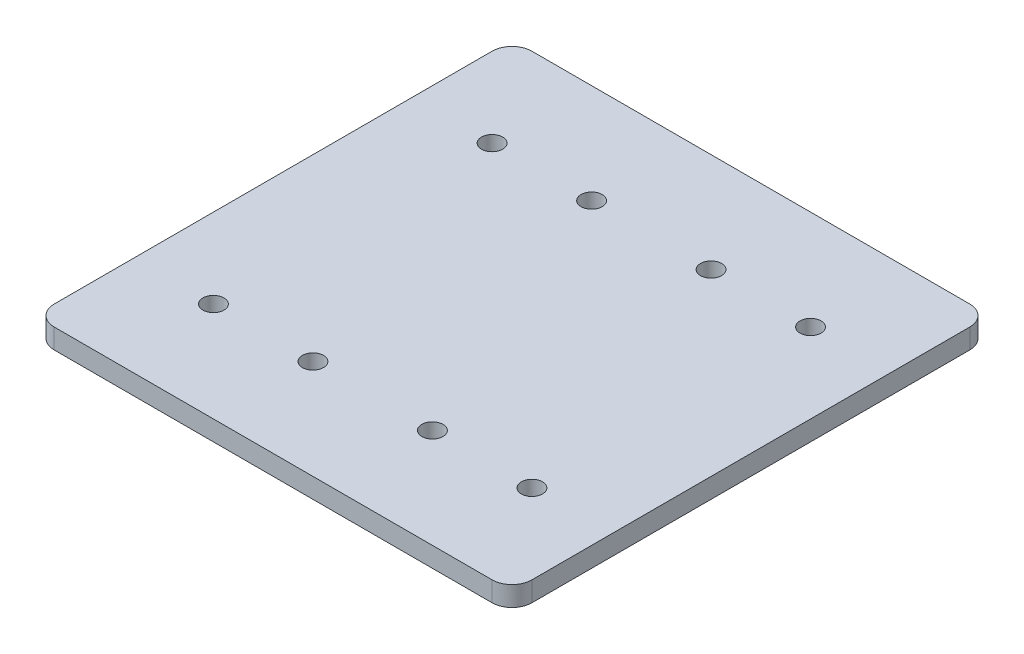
SolidWorks part; units mm, degrees
ref_plane "Front" through (0, 0, 0) normal (0, 0, 1) x (1, 0, 0)
ref_plane "Top" through (0, 0, 0) normal (0, 1, 0) x (1, 0, 0)
ref_plane "Right" through (0, 0, 0) normal (1, 0, 0) x (0, 0, -1)
sketch "Sketch1" plane through (0, 0, 0) normal (0, 1, 0) x (1, 0, 0)
  line L0 (0, 152.4) -> (152.4, 0) construction
  line L1 (6.35, 0) -> (146.05, 0)
  line L2 (0, 6.35) -> (0, 146.05)
  line L3 (6.35, 152.4) -> (146.05, 152.4)
  line L4 (152.4, 6.35) -> (152.4, 146.05)
  line L5 (152.4, 152.4) -> (0, 0) construction
  line L10 (76.2, 152.4) -> (76.2, 173.2992) construction
  line L11 (152.4, 76.2) -> (177.2582, 76.2) construction
  line L12 (152.4, 76.2) -> (-18.6273, 76.2) construction
  line L13 (28.7731, 31.75) -> (60.1269, 31.75) construction
  arc A0 (146.05, 152.4) -> (152.4, 146.05) centre (146.05, 146.05) cw
  arc A1 (0, 146.05) -> (6.35, 152.4) centre (6.35, 146.05) cw
  arc A2 (0, 6.35) -> (6.35, 0) centre (6.35, 6.35) ccw
  arc A3 (152.4, 6.35) -> (146.05, 0) centre (146.05, 6.35) cw
  circle A4 centre (25.4, 31.75) radius 3.3731
  circle A5 centre (57.15, 31.75) radius 3.3731
  circle A6 centre (25.4, 120.65) radius 3.3731
  circle A7 centre (57.15, 120.65) radius 3.3731
  circle A8 centre (127, 31.75) radius 3.3731
  circle A9 centre (127, 120.65) radius 3.3731
  circle A10 centre (95.25, 120.65) radius 3.3731
  circle A11 centre (95.25, 31.75) radius 3.3731
  dimension "D7" = 6.35
  dimension "D9" = 31.75
  dimension "D10" = 6.7462
  dimension "D12" = 31.75
  dimension "D1" = 152.4
  dimension "D2" = 152.4
  dimension "D8" = 25.4
  dimension "D11" = 31.75
extrude "Extrude1" add sketch "Sketch1" along normal blind 6.35
sketch "Sketch2" plane through (0, 0, 0) normal (0, -1, 0) x (1, 0, 0)
  line L0 (1.8599, -1.8599) -> (150.5401, -150.5401) construction
  line L1 (150.5401, -1.8599) -> (1.8599, -150.5401) construction
  arc A0 (6.35, 0) -> (0, -6.35) centre (6.35, -6.35) ccw construction
  arc A1 (146.05, -152.4) -> (152.4, -146.05) centre (146.05, -146.05) ccw construction
  arc A2 (152.4, -6.35) -> (146.05, 0) centre (146.05, -6.35) ccw construction
  arc A3 (0, -146.05) -> (6.35, -152.4) centre (6.35, -146.05) ccw construction
  point P16 (76.2, -76.2)
